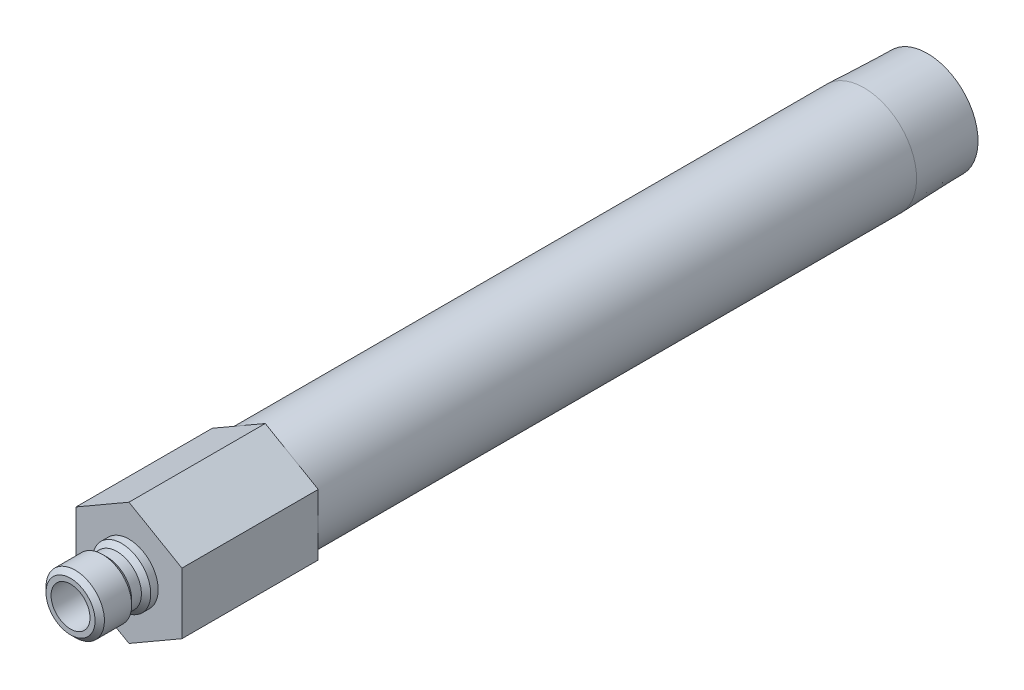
SolidWorks part; units mm, degrees
ref_plane "Front Plane" through (0, 0, 0) normal (0, 0, 1) x (1, 0, 0)
ref_plane "Top Plane" through (0, 0, 0) normal (0, 1, 0) x (1, 0, 0)
ref_plane "Right Plane" through (0, 0, 0) normal (1, 0, 0) x (0, 0, -1)
sketch "Sketch1" plane through (0, 0, 0) normal (1, 0, 0) x (0, 0, -1)
  line L0 (0, 0) -> (-12.7, 0) construction
  line L1 (-9.525, 3.175) -> (-9.525, 4.0005)
  line L2 (-3.556, 4.0005) -> (-3.556, 0) construction
  line L3 (-8.763, 4.7625) -> (-4.318, 4.7625)
  line L4 (0, 8.5725) -> (0, 0) construction
  line L5 (-3.556, 4.0005) -> (-1.9685, 4.0005)
  line L6 (-1.2065, 4.7625) -> (0, 4.7625)
  line L7 (0, 4.7625) -> (0, 8.5725)
  line L8 (-3.556, 4.0005) -> (-4.318, 4.7625)
  line L9 (-1.9685, 4.0005) -> (-1.2065, 4.7625)
  line L10 (-9.525, 4.0005) -> (-8.763, 4.7625)
  line L11 (-9.525, 3.175) -> (22.225, 3.175)
  line L12 (0, 8.5725) -> (119.8372, 8.5725)
  line L13 (119.8372, 8.5725) -> (130.175, 8.2494)
  line L14 (130.175, 8.2494) -> (130.175, 6.2611)
  line L15 (0, 0) -> (22.225, 0) construction
  line L16 (22.225, 0) -> (22.225, 3.175) construction
  line L17 (22.225, 4.7625) -> (0, 4.7625) construction
  line L18 (22.225, 3.175) -> (22.225, 6.2611)
  line L19 (22.225, 6.2611) -> (130.175, 6.2611)
  line L20 (22.225, 3.175) -> (22.225, 4.7625) construction
  dimension "D1" = 9.525
  dimension "D2" = 1.5875
  dimension "D3" = 0.762
  dimension "D4" = 45
  dimension "D5" = 5.969
  dimension "D6" = 45
  dimension "D7" = 1.79
  dimension "D8" = 10.3378
  dimension "D9" = 139.7
  dimension "D10" = 3.175
  dimension "D11" = 31.75
  dimension "D12" = 6.35
  dimension "D13" = 12.5222
  dimension "D14" = 9.525
  dimension "D15" = 17.145
revolve "Revolve1" add sketch "Sketch1" angle 360 about L0
sketch "Sketch2" plane through (0, 0, 0) normal (0, 0, 1) x (1, 0, 0)
  line L1 (-8.636, 4.986) -> (-8.636, -4.986)
  line L2 (-8.636, -4.986) -> (0, -9.972)
  line L3 (0, -9.972) -> (8.636, -4.986)
  line L4 (8.636, -4.986) -> (8.636, 4.986)
  line L5 (8.636, 4.986) -> (0, 9.972)
  line L6 (0, 9.972) -> (-8.636, 4.986)
  circle A0 centre (0, 0) radius 8.636 construction
  circle A1 centre (0, 0) radius 3.175 construction
  circle A2 centre (0, 0) radius 3.175
  dimension "D1" = 17.272
extrude "Boss-Extrude1" add sketch "Sketch2" against normal up to vertex (22.225 mm away) from vertex at 0
